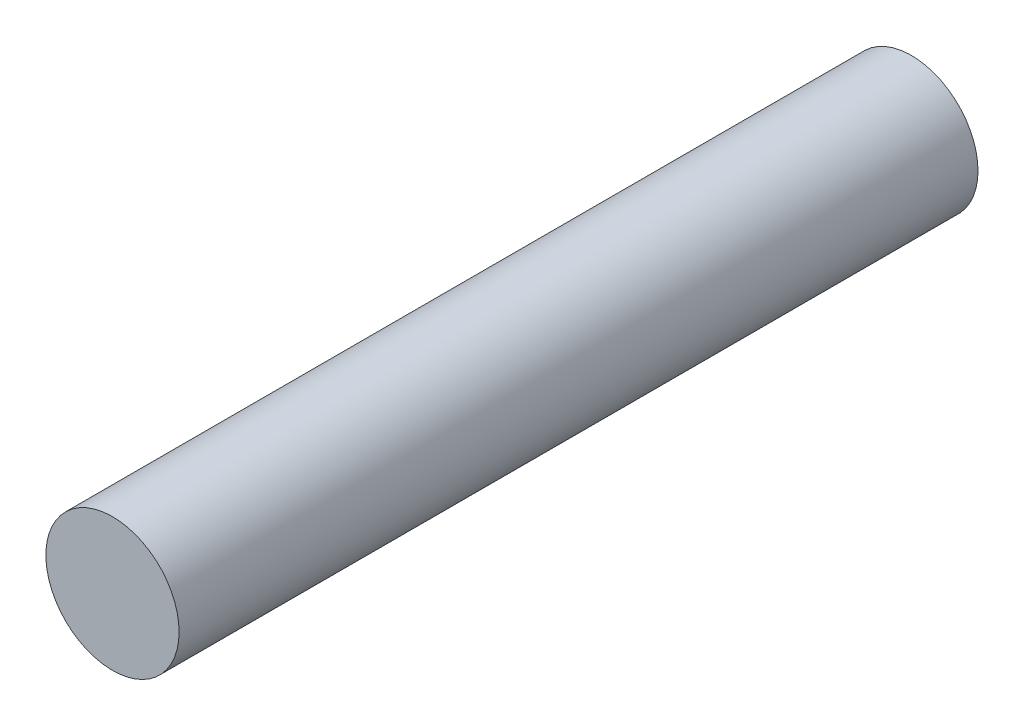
SolidWorks part; units mm, degrees
ref_plane "Face" through (0, 0, 0) normal (0, 0, 1) x (1, 0, 0)
ref_plane "Dessus" through (0, 0, 0) normal (0, 1, 0) x (1, 0, 0)
ref_plane "Droite" through (0, 0, 0) normal (1, 0, 0) x (0, 0, -1)
sketch "Esquisse1" plane through (0, 0, 0) normal (0, 0, 1) x (1, 0, 0)
  circle A0 centre (0, 0) radius 1.25
  dimension "D1" = 2.5
extrude "Base-Extrusion" add sketch "Esquisse1" along normal blind 14.99
